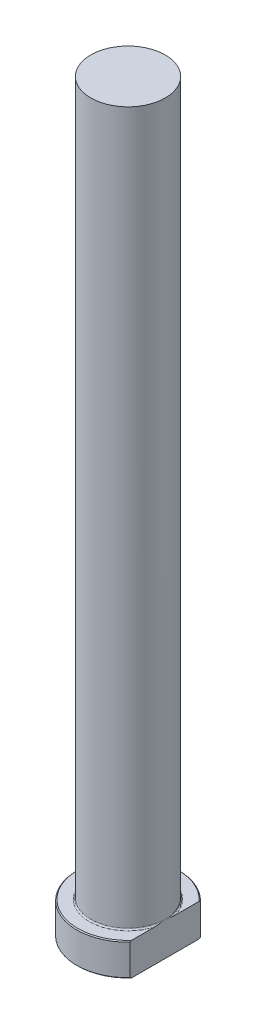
SolidWorks part; units mm, degrees
ref_plane "Front Plane" through (0, 0, 0) normal (0, 0, 1) x (1, 0, 0)
ref_plane "Top Plane" through (0, 0, 0) normal (0, 1, 0) x (1, 0, 0)
ref_plane "Right Plane" through (0, 0, 0) normal (1, 0, 0) x (0, 0, -1)
sketch "Sketch1" plane through (0, 0, 0) normal (0, 0, 1) x (1, 0, 0)
  line L0 (0, 259.9588) -> (0, -15.1925) construction
  line L1 (0, 0) -> (-11, 0)
  line L2 (-11, 0) -> (-11, 7)
  line L3 (-11, 7) -> (-8, 7)
  line L4 (-8, 7) -> (-8, 160)
  line L5 (-8, 160) -> (0, 160)
  line L6 (0, 160) -> (0, 0)
  dimension "L" = 160
  dimension "H" = 22
  dimension "T" = 7
  dimension "D" = 16
revolve "Revolve1" add sketch "Sketch1" angle 360 about L0
chamfer "Chamfer1" distance 0.2 angle 45 2 edges at (0, 7, 11) (0, 0, 11)
fillet "Fillet1" radius 0.3 1 edges at (0, 7, 8)
sketch "Sketch2" plane through (0, 0, 0) normal (0, 1, 0) x (1, 0, 0)
  line L0 (8, 7.5498) -> (8, -7.5498)
  circle A0 centre (0, 0) radius 11 construction
  arc A1 (8, -7.5498) -> (8, 7.5498) centre (0, 0) ccw
  circle A2 centre (0, 0) radius 8 construction
extrude "KEY" cut sketch "Sketch2" along normal through all
